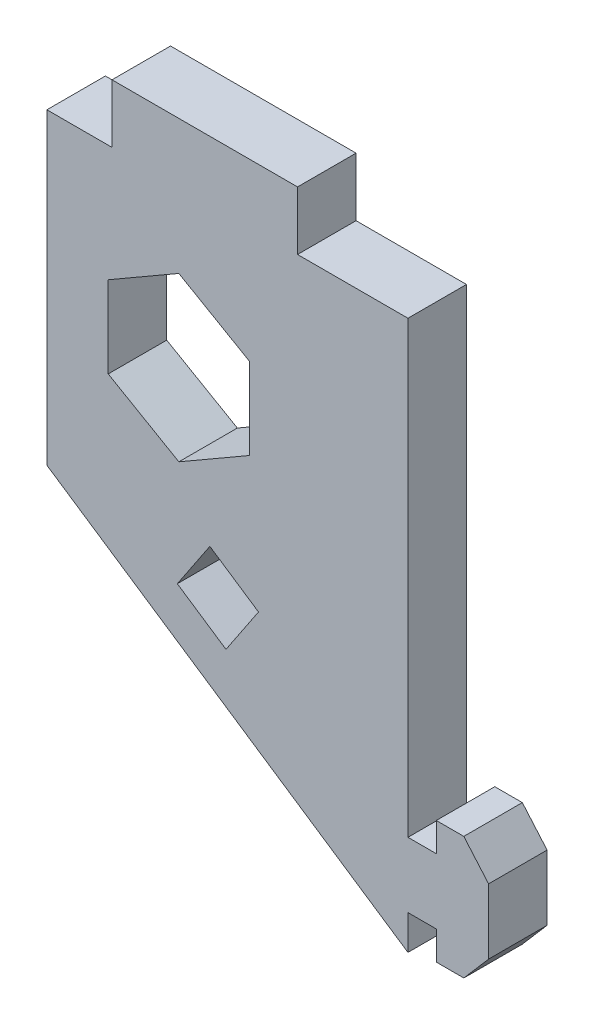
SolidWorks part; units mm, degrees
ref_plane "Front Plane" through (0, 0, 0) normal (0, 0, 1) x (1, 0, 0)
ref_plane "Top Plane" through (0, 0, 0) normal (0, 1, 0) x (1, 0, 0)
ref_plane "Right Plane" through (0, 0, 0) normal (1, 0, 0) x (0, 0, -1)
sketch "Sketch1" plane through (0, 0, 0) normal (0, 0, 1) x (1, 0, 0)
  line L0 (-810.6461, 360.5679) -> (-804.1461, 356.8151)
  line L1 (-804.1461, 356.8151) -> (-804.1461, 349.3096)
  line L2 (-789.5641, 351.5738) -> (-786.9574, 351.5738)
  line L3 (-789.5641, 345.5758) -> (-789.5641, 351.9105)
  line L4 (-786.9574, 351.5738) -> (-786.9574, 354.2181)
  line L5 (-789.5641, 345.5758) -> (-786.9574, 345.5758)
  line L6 (-792.8378, 372.9252) -> (-789.5641, 372.9252)
  line L7 (-804.1461, 349.3096) -> (-810.6461, 345.5568)
  line L8 (-810.6461, 345.5568) -> (-817.1461, 349.3096)
  line L9 (-789.5641, 351.5738) -> (-789.5641, 372.9252)
  line L10 (-822.7879, 339.2105) -> (-789.5641, 317.0008)
  line L11 (-792.8378, 372.9252) -> (-822.7879, 372.9252)
  line L12 (-822.7879, 372.9252) -> (-822.7879, 339.2105)
  line L13 (-789.5641, 345.5758) -> (-789.5641, 326.1738)
  line L14 (-786.9574, 354.2181) -> (-784.4248, 354.2181)
  line L15 (-784.4248, 354.2181) -> (-782.1447, 351.5738)
  line L16 (-782.1447, 351.5738) -> (-782.1447, 345.5758)
  line L17 (-786.9574, 326.1738) -> (-786.9574, 328.8181)
  line L18 (-810.6461, 360.5679) -> (-817.1461, 356.8151)
  line L19 (-817.1461, 356.8151) -> (-817.1461, 349.3096)
  line L21 (-784.4248, 342.9316) -> (-782.1447, 345.5758)
  line L22 (-786.9574, 342.9316) -> (-784.4248, 342.9316)
  line L23 (-786.9574, 345.5758) -> (-786.9574, 342.9316)
  line L24 (-786.9574, 328.8181) -> (-784.4248, 328.8181)
  line L25 (-784.4248, 328.8181) -> (-782.1447, 326.1738)
  line L26 (-782.1447, 320.1758) -> (-782.1447, 326.1738)
  line L27 (-784.4248, 317.5316) -> (-782.1447, 320.1758)
  line L28 (-786.9574, 317.5316) -> (-784.4248, 317.5316)
  line L29 (-789.5641, 326.1738) -> (-786.9574, 326.1738)
  line L30 (-786.9574, 320.1758) -> (-786.9574, 317.5316)
  line L31 (-789.5641, 320.1758) -> (-786.9574, 320.1758)
  line L32 (-789.5641, 320.1758) -> (-789.5641, 317.0008)
  dimension "D1" = 33.7147
extrude "Boss-Extrude1" add sketch "Sketch1" along normal blind 5.3848
sketch "Sketch2" plane through (0, 0, 5.3848) normal (0, 0, 1) x (1, 0, 0)
  line L0 (-822.7879, 372.9252) -> (-789.5641, 372.9252) construction
  line L1 (-789.5641, 326.1738) -> (-789.5641, 372.9252) construction
  line L2 (-816.7977, 367.5404) -> (-816.7977, 372.9252)
  line L3 (-816.7977, 372.9252) -> (-822.7879, 372.9252)
  line L4 (-822.7879, 367.5404) -> (-822.7879, 372.9252)
  line L5 (-816.7977, 367.5404) -> (-822.7879, 367.5404)
  line L7 (-799.7241, 372.9252) -> (-789.5641, 372.9252)
  line L8 (-799.7241, 372.9252) -> (-799.7241, 367.5404)
  line L9 (-799.7241, 367.5404) -> (-789.5641, 367.5404)
  line L10 (-789.5641, 372.9252) -> (-789.5641, 367.5404)
  dimension "D1" = 10.16
extrude "Cut-Extrude1" cut sketch "Sketch2" against normal up to surface (5.3848 mm away)
sketch "Sketch3" plane through (0, 0, 5.3848) normal (0, 0, 1) x (1, 0, 0)
  line L1 (-803.3166, 337.2542) -> (-806.3092, 332.7776)
  line L2 (-806.3092, 332.7776) -> (-810.7858, 335.7701)
  line L3 (-810.7858, 335.7701) -> (-807.7933, 340.2468)
  line L4 (-822.7879, 339.2105) -> (-789.5641, 317.0008) construction
  line L5 (-807.7933, 340.2468) -> (-803.3166, 337.2542)
  dimension "D1" = 3.81
extrude "Cut-Extrude2" cut sketch "Sketch3" against normal up to surface (5.3848 mm away)
